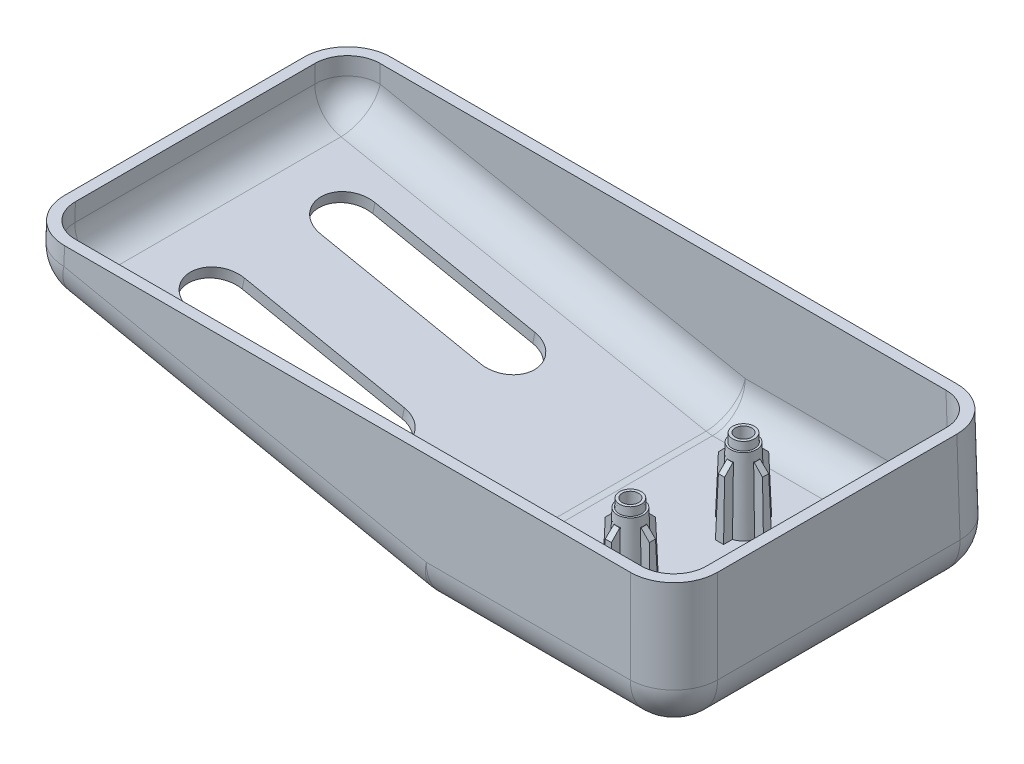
SolidWorks part; units mm, degrees
ref_plane "Front Plane" through (0, 0, 0) normal (0, 0, 1) x (1, 0, 0)
ref_plane "Top Plane" through (0, 0, 0) normal (0, 1, 0) x (1, 0, 0)
ref_plane "Right Plane" through (0, 0, 0) normal (1, 0, 0) x (0, 0, -1)
sketch "Sketch1" plane through (0, 0, 0) normal (0, 0, 1) x (1, 0, 0)
  line L0 (-74, 25) -> (46, 25)
  line L1 (46, 25) -> (46, 0)
  line L2 (46, 0) -> (0, 0)
  line L3 (0, 0) -> (-74, 15)
  line L4 (-74, 15) -> (-74, 25)
  dimension "D1" = 46
  dimension "D2" = 25
  dimension "D3" = 10
  dimension "D4" = 120
extrude "Boss-Extrude1" add sketch "Sketch1" along normal mid plane 60
draft "Draft1" type of draft neutral plane draft angle 1 faces to draft 4 parameters "D1"=1
fillet "Fillet1" radius 8 11 edges at (0, 0, 0) (23.2182, 0, 30.4364) (-37.087, 7.5176, 30.3052) (23.2182, 0, -30.4364) (-37.087, 7.5176, -30.3052) (-74.1739, 15.0353, 0) (46.4364, 0, 0) (46.2182, 12.5, -30.2182) (-74.087, 20.0176, 30.087) (-74.087, 20.0176, -30.087) (46.2182, 12.5, 30.2182)
shell "Shell1" thickness 2
sketch "Sketch5" plane through (19.934, -2, 0) normal (-0.1987, -0.9801, 0) x (-0.9801, 0.1987, 0)
  line L0 (47.4256, 12) -> (77.4256, 12) construction
  line L1 (47.4256, 17) -> (77.4256, 17)
  line L2 (47.4256, 7) -> (77.4256, 7)
  line L3 (47.4256, -12) -> (77.4256, -12) construction
  line L4 (47.4256, -7) -> (77.4256, -7)
  line L5 (47.4256, -17) -> (77.4256, -17)
  line L6 (-12.3432, -30) -> (89.5862, -30) construction
  line L8 (97.4256, -22.0012) -> (97.4256, 22.0012) construction
  arc A0 (47.4256, 17) -> (47.4256, 7) centre (47.4256, 12) ccw
  arc A1 (77.4256, 7) -> (77.4256, 17) centre (77.4256, 12) ccw
  arc A2 (47.4256, -7) -> (47.4256, -17) centre (47.4256, -12) ccw
  arc A3 (77.4256, -17) -> (77.4256, -7) centre (77.4256, -12) ccw
  point P2 (62.4256, 12)
  point P8 (62.4256, -12)
  dimension "D5" = 20
  dimension "D1" = 10
  dimension "D2" = 30
  dimension "D3" = 18
  dimension "D4" = 24
extrude "Cut-Extrude1" cut sketch "Sketch5" along normal up to next
sketch3d "3DSketch1"
  point P0 (18.3972, 2, -10.3984)
  dimension "D1" = 28
  dimension "D2" = 20
other "Mounting Boss1" parameters "BossHeight"=14, "BossDiam"=4.8, "StepHeight"=1.5, "StepDia"=4, "HoleDiam"=3, "CBoreDiam"=4, "CBoreDepth"=2, "D8"=0, "D9"=0, "D10"=0, "Clearance"=0.254, "FinLength"=4, "FinWidth"=1.5, "FinHeight"=12, "ChamferDist"=1.5, "BossDraft"=2, "HoleDraft"=1, "StepDraft"=0, "D19"=0, "FinDraft"=1, "ChamferAngle"=45
mirror "Mirror1" about plane through (0, 0, 0) normal (0, 0, 1) of "Mounting Boss1"
